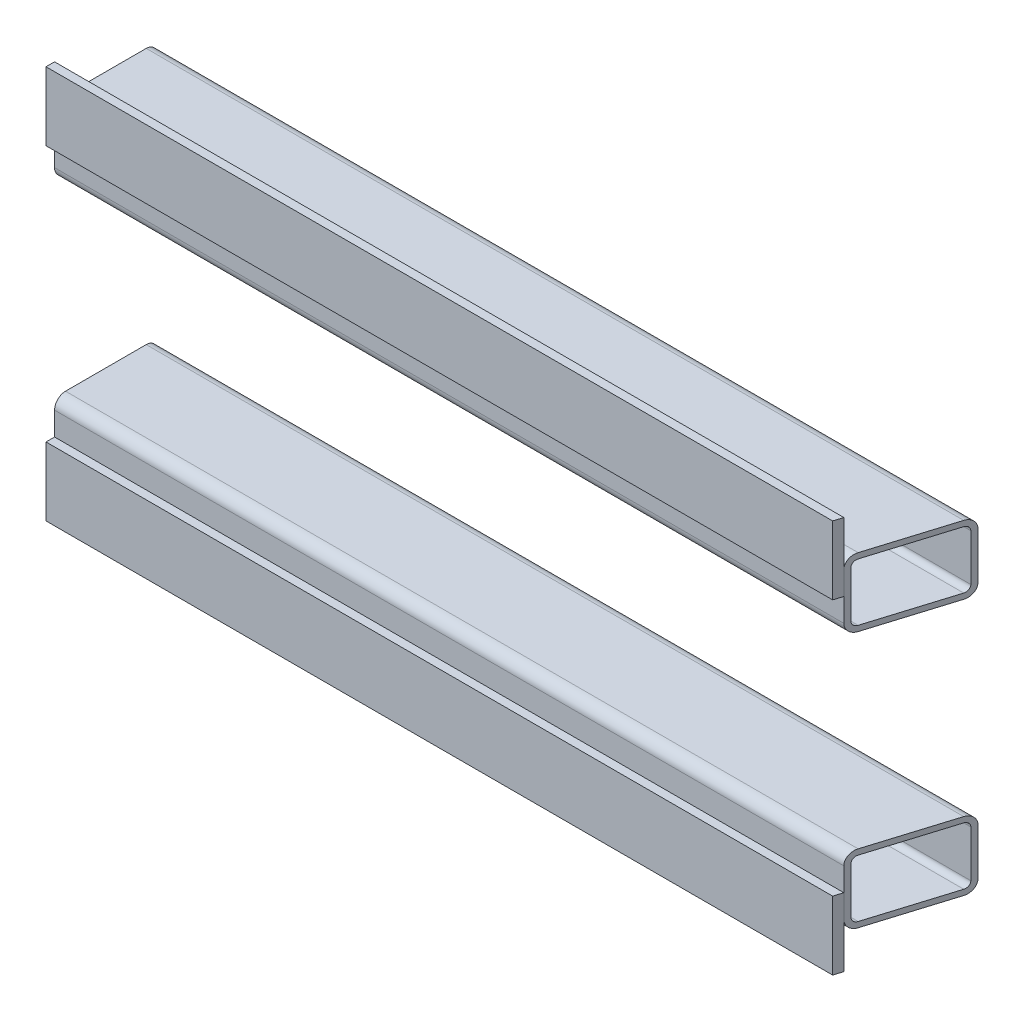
SolidWorks part; units mm, degrees
ref_plane "Ebene vorne" through (0, 0, 0) normal (0, 0, 1) x (1, 0, 0)
ref_plane "Ebene oben" through (0, 0, 0) normal (0, 1, 0) x (1, 0, 0)
ref_plane "Ebene rechts" through (0, 0, 0) normal (1, 0, 0) x (0, 0, -1)
sketch "Skizze1" plane through (0, 0, 0) normal (0, 0, 1) x (1, 0, 0)
  line L1 (-2336.1476, -7365.843) -> (-1856.1476, -7365.843)
  line L4 (-2336.1476, -7555.843) -> (-1856.1476, -7555.843)
  line L5 (-2096.1476, -7365.843) -> (-2096.1476, -7555.843) construction
  line L6 (-2096.1476, -7460.843) -> (-2210.8628, -7460.843) construction
  dimension "D1" = 190
  dimension "D2" = 480
other "Strukturbauteil1"
ref_plane "Ebene1" through (-2336.1476, -7365.843, 0) normal (1, 0, 0) x (0, 0, 1)
sketch "Sketch1" plane through (-2336.1476, -7385.843, 30) normal (1, 0, 0) x (0, 1, 0)
  line L0 (-13.6, -26.8) -> (13.6, -26.8)
  line L1 (-16.8, -23.6) -> (-16.8, 23.6)
  line L2 (13.6, 26.8) -> (-13.6, 26.8)
  line L3 (16.8, 23.6) -> (16.8, -23.6)
  line L4 (-13.6, -30) -> (13.6, -30)
  line L5 (-20, -23.6) -> (-20, 23.6)
  line L6 (13.6, 30) -> (-13.6, 30)
  line L7 (20, 23.6) -> (20, -23.6)
  arc A0 (20, 23.6) -> (13.6, 30) centre (13.6, 23.6) ccw
  arc A1 (13.6, -30) -> (20, -23.6) centre (13.6, -23.6) ccw
  arc A2 (-20, -23.6) -> (-13.6, -30) centre (-13.6, -23.6) ccw
  arc A3 (-13.6, 30) -> (-20, 23.6) centre (-13.6, 23.6) ccw
  arc A4 (-13.6, 26.8) -> (-16.8, 23.6) centre (-13.6, 23.6) ccw
  arc A5 (16.8, 23.6) -> (13.6, 26.8) centre (13.6, 23.6) ccw
  arc A6 (13.6, -26.8) -> (16.8, -23.6) centre (13.6, -23.6) ccw
  arc A7 (-16.8, -23.6) -> (-13.6, -26.8) centre (-13.6, -23.6) ccw
  point P0 (0, 30)
  point P1 (20, 0)
  point P2 (0, -30)
  point P3 (-20, 0)
  point P4 (-20, 30)
  point P5 (20, 30)
  point P6 (20, -30)
  point P7 (-20, -30)
  point P8 (0, 0)
  point P33 (0, 0)
  dimension "D1" = 6.4
  dimension "Thickness" = 3.2
  dimension "V_leg" = 60
  dimension "H_leg" = 40
other "Strukturbauteil2"
ref_plane "Ebene2" through (-2336.1476, -7555.843, 0) normal (1, 0, 0) x (0, 0, 1)
sketch "Sketch11" plane through (-2336.1476, -7535.843, 30) normal (1, 0, 0) x (0, 1, 0)
  line L0 (-13.6, -26.8) -> (13.6, -26.8)
  line L1 (-16.8, -23.6) -> (-16.8, 23.6)
  line L2 (13.6, 26.8) -> (-13.6, 26.8)
  line L3 (16.8, 23.6) -> (16.8, -23.6)
  line L4 (-13.6, -30) -> (13.6, -30)
  line L5 (-20, -23.6) -> (-20, 23.6)
  line L6 (13.6, 30) -> (-13.6, 30)
  line L7 (20, 23.6) -> (20, -23.6)
  arc A0 (20, 23.6) -> (13.6, 30) centre (13.6, 23.6) ccw
  arc A1 (13.6, -30) -> (20, -23.6) centre (13.6, -23.6) ccw
  arc A2 (-20, -23.6) -> (-13.6, -30) centre (-13.6, -23.6) ccw
  arc A3 (-13.6, 30) -> (-20, 23.6) centre (-13.6, 23.6) ccw
  arc A4 (-13.6, 26.8) -> (-16.8, 23.6) centre (-13.6, 23.6) ccw
  arc A5 (16.8, 23.6) -> (13.6, 26.8) centre (13.6, 23.6) ccw
  arc A6 (13.6, -26.8) -> (16.8, -23.6) centre (13.6, -23.6) ccw
  arc A7 (-16.8, -23.6) -> (-13.6, -26.8) centre (-13.6, -23.6) ccw
  point P0 (0, 30)
  point P1 (20, 0)
  point P2 (0, -30)
  point P3 (-20, 0)
  point P4 (-20, 30)
  point P5 (20, 30)
  point P6 (20, -30)
  point P7 (-20, -30)
  point P8 (0, 0)
  point P33 (0, 0)
  dimension "D1" = 6.4
  dimension "Thickness" = 3.2
  dimension "V_leg" = 60
  dimension "H_leg" = 40
sketch "Skizze3" plane through (-1856.1476, 0, 0) normal (1, 0, 0) x (0, 0, -1)
  line L0 (-60, -7372.243) -> (-60, -7399.443) construction
  line L1 (-60, -7345.843) -> (-65, -7345.843)
  line L2 (-60, -7345.843) -> (-60, -7385.843)
  line L3 (-60, -7385.843) -> (-65, -7385.843)
  line L4 (-65, -7345.843) -> (-65, -7385.843)
  line L6 (0, -7460.843) -> (-135.5047, -7460.843) construction
  line L8 (-65, -7575.843) -> (-65, -7535.843)
  line L9 (-60, -7535.843) -> (-65, -7535.843)
  line L10 (-60, -7575.843) -> (-60, -7535.843)
  line L11 (-60, -7575.843) -> (-65, -7575.843)
  line L12 (-6.4, -7365.843) -> (-53.6, -7365.843) construction
  dimension "D1" = 20
  dimension "D2" = 40
  dimension "D3" = 5
extrude "Linear austragen1" add sketch "Skizze3" against normal up to vertex separate body
sketch "Skizze5" plane through (0, -7345.843, 0) normal (0, 1, 0) x (1, 0, 0)
  line L0 (-1856.1476, 0) -> (-1876.1476, -65)
  line L1 (-2336.1476, -65) -> (-1856.1476, -65) construction
  line L2 (-1856.1476, 0) -> (-1856.1476, -65)
  line L4 (-1856.1476, -65) -> (-1876.1476, -65)
  dimension "D1" = 20
extrude "Schnitt-Linear austragen1" cut sketch "Skizze5" against normal through all
equation "\"LÄNGE\"=0"
equation "\"BREITE\"=0"
equation "\"HÖHE\"=0"
equation "\"DURCHMESSER\"=0"
equation "\"Stückzahl\"= 1"
